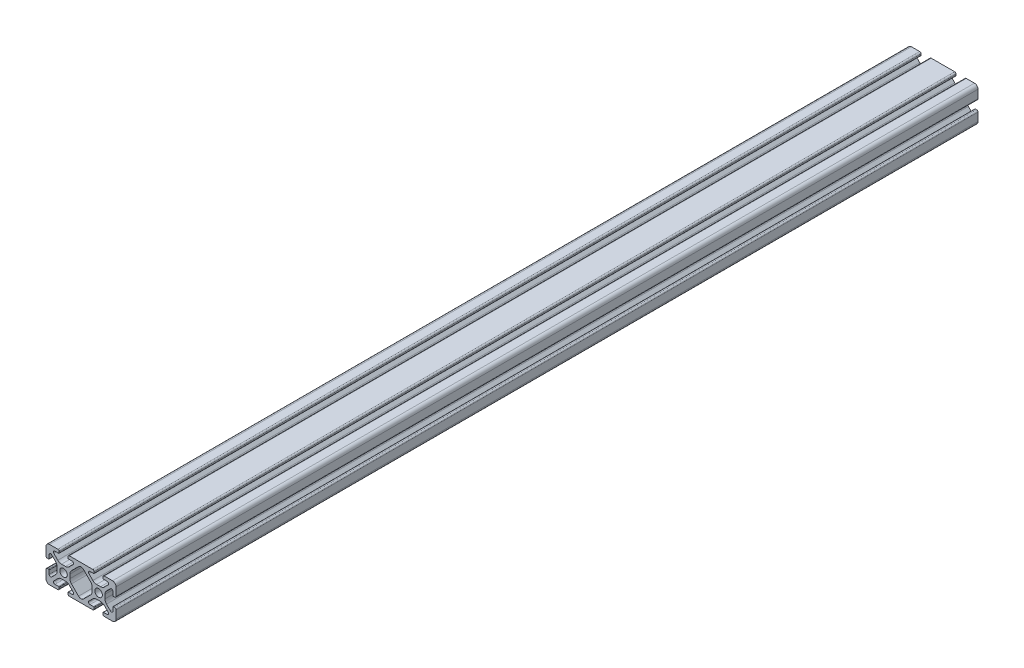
SolidWorks part; units mm, degrees
ref_plane "Aufriss" through (0, 0, 0) normal (0, 0, 1) x (1, 0, 0)
ref_plane "Grundriss" through (0, 0, 0) normal (0, 1, 0) x (1, 0, 0)
ref_plane "Seitenriss" through (0, 0, 0) normal (1, 0, 0) x (0, 0, -1)
sketch "Skizze1" plane through (0, 0, 0) normal (0, 0, 1) x (1, 0, 0)
  line L0 (32.5, 1.5) -> (32.5, 0.8)
  line L1 (33.3, 0) -> (38, 0)
  line L2 (40, 2) -> (40, 6.7)
  line L3 (39.2, 7.5) -> (38.5, 7.5)
  line L4 (38.2, 7.2) -> (38.2, 5.0816)
  line L5 (36.7804, 4.4936) -> (34.5287, 6.7453)
  line L6 (33.65, 8.8666) -> (33.65, 11.1334)
  line L7 (34.5287, 13.2547) -> (36.7804, 15.5064)
  line L8 (38.2, 14.9184) -> (38.2, 12.8)
  line L9 (38.5, 12.5) -> (39.2, 12.5)
  line L10 (40, 13.3) -> (40, 18)
  line L11 (38, 20) -> (33.3, 20)
  line L12 (32.5, 19.2) -> (32.5, 18.5)
  line L13 (32.8, 18.2) -> (34.9196, 18.2)
  line L14 (35.5076, 16.7804) -> (33.2559, 14.5287)
  line L15 (31.1346, 13.65) -> (28.8666, 13.65)
  line L16 (26.7453, 14.5287) -> (24.4936, 16.7804)
  line L17 (25.0816, 18.2) -> (27.2, 18.2)
  line L18 (27.5, 18.5) -> (27.5, 19.2)
  line L19 (26.7, 20) -> (13.3, 20)
  line L20 (12.5, 19.2) -> (12.5, 18.5)
  line L21 (12.8, 18.2) -> (14.9184, 18.2)
  line L22 (15.5064, 16.7804) -> (13.2547, 14.5287)
  line L23 (11.1334, 13.65) -> (8.8666, 13.65)
  line L24 (6.7453, 14.5287) -> (4.4936, 16.7804)
  line L25 (5.0816, 18.2) -> (7.2, 18.2)
  line L26 (7.5, 18.5) -> (7.5, 19.2)
  line L27 (6.7, 20) -> (2, 20)
  line L28 (0, 18) -> (0, 13.3)
  line L29 (0.8, 12.5) -> (1.5, 12.5)
  line L30 (1.8, 12.8) -> (1.8, 14.9184)
  line L31 (3.2196, 15.5064) -> (5.4713, 13.2547)
  line L32 (6.35, 11.1334) -> (6.35, 8.8666)
  line L33 (5.4713, 6.7453) -> (3.2196, 4.4936)
  line L34 (1.8, 5.0816) -> (1.8, 7.2)
  line L35 (1.5, 7.5) -> (0.8, 7.5)
  line L36 (0, 6.7) -> (0, 2)
  line L37 (2, 0) -> (6.7, 0)
  line L38 (7.5, 0.8) -> (7.5, 1.5)
  line L39 (7.2, 1.8) -> (5.0816, 1.8)
  line L40 (4.4936, 3.2196) -> (6.7453, 5.4713)
  line L41 (8.8666, 6.35) -> (11.1334, 6.35)
  line L42 (13.2547, 5.4713) -> (15.5064, 3.2196)
  line L43 (14.9184, 1.8) -> (12.8, 1.8)
  line L44 (12.5, 1.5) -> (12.5, 0.8)
  line L45 (13.3, 0) -> (26.7, 0)
  line L46 (27.5, 0.8) -> (27.5, 1.5)
  line L47 (27.2, 1.8) -> (25.0816, 1.8)
  line L48 (24.4936, 3.2196) -> (26.7453, 5.4713)
  line L49 (28.8666, 6.35) -> (31.1346, 6.35)
  line L50 (33.2559, 5.4713) -> (35.5076, 3.2196)
  line L51 (34.9196, 1.8) -> (32.8, 1.8)
  line L52 (18.5864, 2.6876) -> (14.5293, 6.7447)
  line L53 (13.6506, 8.866) -> (13.6506, 11.134)
  line L54 (14.5293, 13.2553) -> (18.5864, 17.3124)
  line L55 (21.4148, 17.3124) -> (25.4719, 13.2553)
  line L56 (26.3506, 11.134) -> (26.3506, 8.866)
  line L57 (25.4719, 6.7447) -> (21.4148, 2.6876)
  arc A0 (32.8, 1.8) -> (32.5, 1.5) centre (32.8, 1.5) ccw
  arc A1 (32.5, 0.8) -> (33.3, 0) centre (33.3, 0.8) ccw
  arc A2 (38, 0) -> (40, 2) centre (38, 2) ccw
  arc A3 (40, 6.7) -> (39.2, 7.5) centre (39.2, 6.7) ccw
  arc A4 (38.5, 7.5) -> (38.2, 7.2) centre (38.5, 7.2) ccw
  arc A5 (38.2, 5.0816) -> (36.7804, 4.4936) centre (37.3684, 5.0816) cw
  arc A6 (34.5287, 6.7453) -> (33.65, 8.8666) centre (36.65, 8.8666) cw
  arc A7 (33.65, 11.1334) -> (34.5287, 13.2547) centre (36.65, 11.1334) cw
  arc A8 (36.7804, 15.5064) -> (38.2, 14.9184) centre (37.3684, 14.9184) cw
  arc A9 (38.2, 12.8) -> (38.5, 12.5) centre (38.5, 12.8) ccw
  arc A10 (39.2, 12.5) -> (40, 13.3) centre (39.2, 13.3) ccw
  arc A11 (40, 18) -> (38, 20) centre (38, 18) ccw
  arc A12 (33.3, 20) -> (32.5, 19.2) centre (33.3, 19.2) ccw
  arc A13 (32.5, 18.5) -> (32.8, 18.2) centre (32.8, 18.5) ccw
  arc A14 (34.9196, 18.2) -> (35.5076, 16.7804) centre (34.9196, 17.3684) cw
  arc A15 (33.2559, 14.5287) -> (31.1346, 13.65) centre (31.1346, 16.65) cw
  arc A16 (28.8666, 13.65) -> (26.7453, 14.5287) centre (28.8666, 16.65) cw
  arc A17 (24.4936, 16.7804) -> (25.0816, 18.2) centre (25.0816, 17.3684) cw
  arc A18 (27.2, 18.2) -> (27.5, 18.5) centre (27.2, 18.5) ccw
  arc A19 (27.5, 19.2) -> (26.7, 20) centre (26.7, 19.2) ccw
  arc A20 (13.3, 20) -> (12.5, 19.2) centre (13.3, 19.2) ccw
  arc A21 (12.5, 18.5) -> (12.8, 18.2) centre (12.8, 18.5) ccw
  arc A22 (14.9184, 18.2) -> (15.5064, 16.7804) centre (14.9184, 17.3684) cw
  arc A23 (13.2547, 14.5287) -> (11.1334, 13.65) centre (11.1334, 16.65) cw
  arc A24 (8.8666, 13.65) -> (6.7453, 14.5287) centre (8.8666, 16.65) cw
  arc A25 (4.4936, 16.7804) -> (5.0816, 18.2) centre (5.0816, 17.3684) cw
  arc A26 (7.2, 18.2) -> (7.5, 18.5) centre (7.2, 18.5) ccw
  arc A27 (7.5, 19.2) -> (6.7, 20) centre (6.7, 19.2) ccw
  arc A28 (2, 20) -> (0, 18) centre (2, 18) ccw
  arc A29 (0, 13.3) -> (0.8, 12.5) centre (0.8, 13.3) ccw
  arc A30 (1.5, 12.5) -> (1.8, 12.8) centre (1.5, 12.8) ccw
  arc A31 (1.8, 14.9184) -> (3.2196, 15.5064) centre (2.6316, 14.9184) cw
  arc A32 (5.4713, 13.2547) -> (6.35, 11.1334) centre (3.35, 11.1334) cw
  arc A33 (6.35, 8.8666) -> (5.4713, 6.7453) centre (3.35, 8.8666) cw
  arc A34 (3.2196, 4.4936) -> (1.8, 5.0816) centre (2.6316, 5.0816) cw
  arc A35 (1.8, 7.2) -> (1.5, 7.5) centre (1.5, 7.2) ccw
  arc A36 (0.8, 7.5) -> (0, 6.7) centre (0.8, 6.7) ccw
  arc A37 (0, 2) -> (2, 0) centre (2, 2) ccw
  arc A38 (6.7, 0) -> (7.5, 0.8) centre (6.7, 0.8) ccw
  arc A39 (7.5, 1.5) -> (7.2, 1.8) centre (7.2, 1.5) ccw
  arc A40 (5.0816, 1.8) -> (4.4936, 3.2196) centre (5.0816, 2.6316) cw
  arc A41 (6.7453, 5.4713) -> (8.8666, 6.35) centre (8.8666, 3.35) cw
  arc A42 (11.1334, 6.35) -> (13.2547, 5.4713) centre (11.1334, 3.35) cw
  arc A43 (15.5064, 3.2196) -> (14.9184, 1.8) centre (14.9184, 2.6316) cw
  arc A44 (12.8, 1.8) -> (12.5, 1.5) centre (12.8, 1.5) ccw
  arc A45 (12.5, 0.8) -> (13.3, 0) centre (13.3, 0.8) ccw
  arc A46 (26.7, 0) -> (27.5, 0.8) centre (26.7, 0.8) ccw
  arc A47 (27.5, 1.5) -> (27.2, 1.8) centre (27.2, 1.5) ccw
  arc A48 (25.0816, 1.8) -> (24.4936, 3.2196) centre (25.0816, 2.6316) cw
  arc A49 (26.7453, 5.4713) -> (28.8666, 6.35) centre (28.8666, 3.35) cw
  arc A50 (31.1346, 6.35) -> (33.2559, 5.4713) centre (31.1346, 3.35) cw
  arc A51 (35.5076, 3.2196) -> (34.9196, 1.8) centre (34.9196, 2.6316) cw
  circle A52 centre (10, 10) radius 2.15
  circle A53 centre (30, 10) radius 2.15
  arc A54 (21.4148, 2.6876) -> (18.5864, 2.6876) centre (20.0006, 4.1018) cw
  arc A55 (14.5293, 6.7447) -> (13.6506, 8.866) centre (16.6506, 8.866) cw
  arc A56 (13.6506, 11.134) -> (14.5293, 13.2553) centre (16.6506, 11.134) cw
  arc A57 (18.5864, 17.3124) -> (21.4148, 17.3124) centre (20.0006, 15.8982) cw
  arc A58 (25.4719, 13.2553) -> (26.3506, 11.134) centre (23.3506, 11.134) cw
  arc A59 (26.3506, 8.866) -> (25.4719, 6.7447) centre (23.3506, 8.866) cw
  dimension "D1" = 40
  dimension "D2" = 20
extrude "Linear austragen1" add sketch "Skizze1" against normal blind 492
ref_plane "Ebene1" through (10, 0, 0) normal (1, 0, 0) x (0, 0, -1)
ref_plane "Ebene2" through (30, 0, 0) normal (1, 0, 0) x (0, 0, -1)
ref_plane "Ebene3" through (0, 10, 0) normal (0, 1, 0) x (-1, 0, 0)
other "Einfrieren***"
